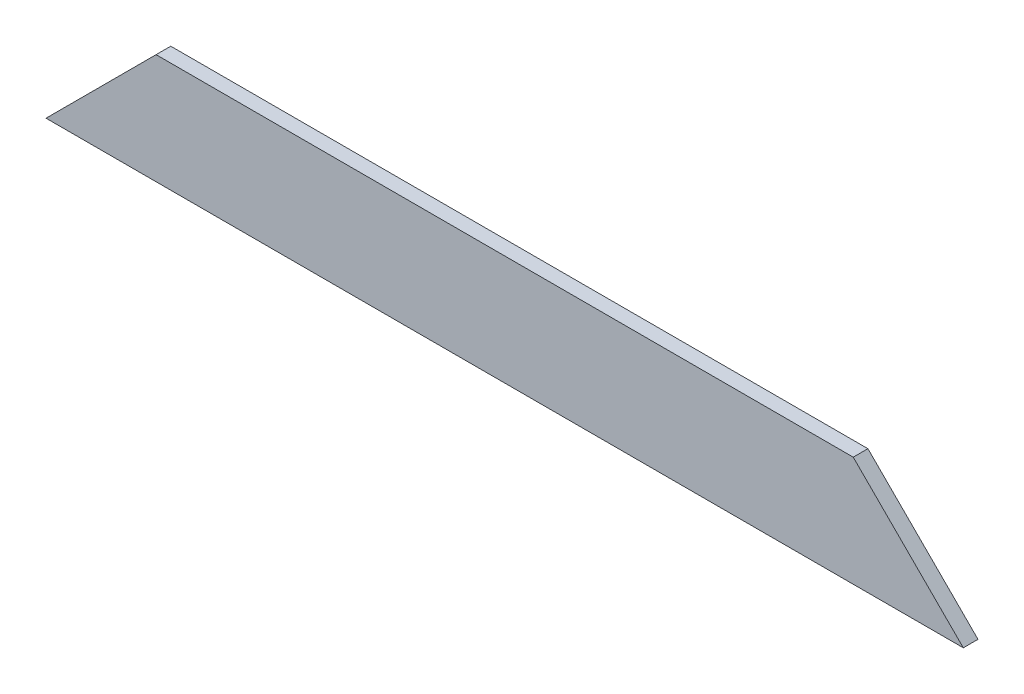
SolidWorks part; units mm, degrees
ref_plane "Face" through (0, 0, 0) normal (0, 0, 1) x (1, 0, 0)
ref_plane "Dessus" through (0, 0, 0) normal (0, 1, 0) x (1, 0, 0)
ref_plane "Droite" through (0, 0, 0) normal (1, 0, 0) x (0, 0, -1)
sketch "Esquisse1" plane through (0, 0, 0) normal (0, 0, 1) x (1, 0, 0)
  line L0 (0, 0) -> (60, 60)
  line L1 (60, 60) -> (440, 60)
  line L2 (440, 60) -> (500, 0)
  line L3 (0, 0) -> (500, 0)
  dimension "D1" = 45
  dimension "D2" = 60
  dimension "D3" = 45
  dimension "D4" = 500
extrude "Base-Extrusion" add sketch "Esquisse1" along normal blind 8
